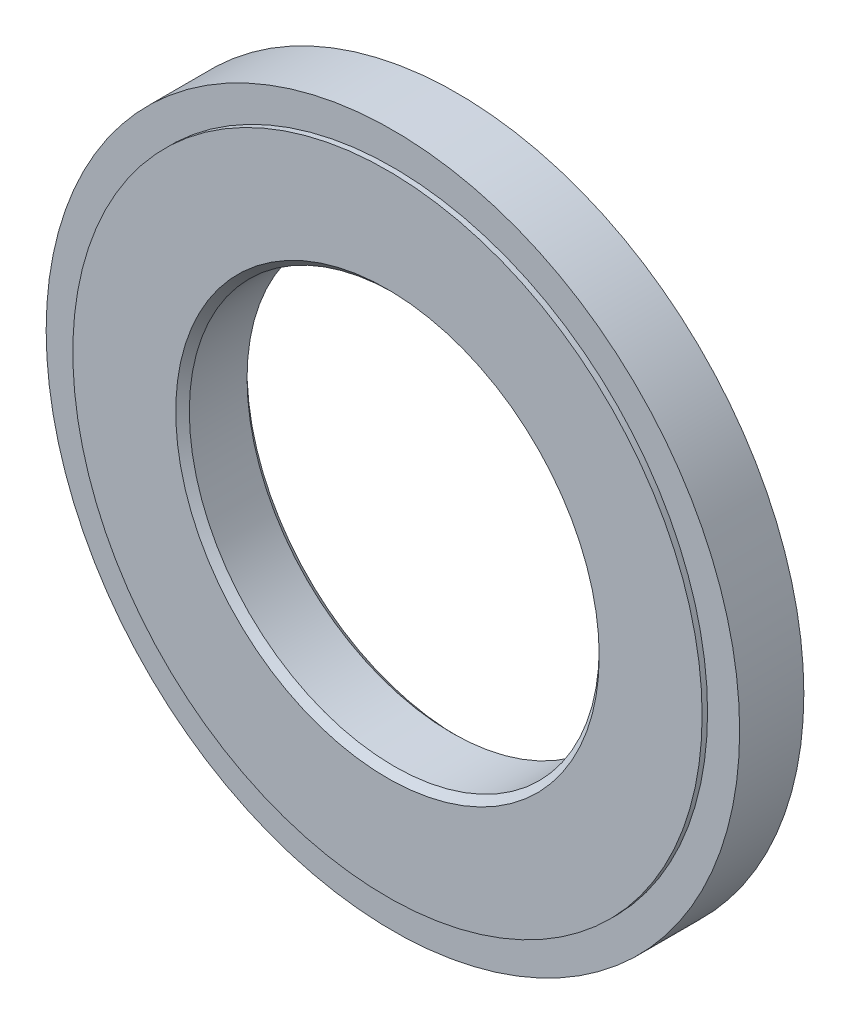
SolidWorks part; units mm, degrees
ref_plane "Front" through (0, 0, 0) normal (0, 0, 1) x (1, 0, 0)
ref_plane "Top" through (0, 0, 0) normal (0, 1, 0) x (1, 0, 0)
ref_plane "Right" through (0, 0, 0) normal (1, 0, 0) x (0, 0, -1)
sketch "Sketch1" plane through (0, 0, 0) normal (0, 0, 1) x (1, 0, 0)
  circle A0 centre (0, 0) radius 102.1
  dimension "OD" = 204.2
extrude "Extrude1" add sketch "Sketch1" along normal mid plane 21
sketch "Sketch2" plane through (0, 0, 10.5) normal (0, 0, 1) x (1, 0, 0)
  circle A0 centre (0, 0) radius 92.65
  dimension "MG" = 185.3
extrude "Cut-Extrude1" cut sketch "Sketch2" against normal blind 1.6 contours A0 M2
sketch "Sketch3" plane through (0, 0, -10.5) normal (0, 0, -1) x (-1, 0, 0)
  circle A0 centre (0, 0) radius 92.65
  dimension "MG" = 185.3
extrude "Cut-Extrude2" cut sketch "Sketch3" against normal blind 0.5 contours A0 M2
sketch "Sketch4" plane through (0, 0, 10.5) normal (0, 0, 1) x (1, 0, 0)
  circle A0 centre (0, 0) radius 60.35
  dimension "BORE" = 120.7
extrude "Cut-Extrude3" cut sketch "Sketch4" against normal through all
sketch "Sketch5" plane through (0, 0, -39) normal (0, 0, 1) x (1, 0, 0)
  point P0 (0, 50)
  point P1 (50, 0)
  point P2 (0, -50)
  point P3 (-50, 0)
  dimension "D1" = 76.2
  dimension "D2" = 76.2
  dimension "D3" = 76.2
  dimension "D4" = 76.2
hole_wizard "M5x0.8 Tapped Hole1" positions "3DSketch1" profile "Sketch6" tap size "M5x0.8" standard "Ansi Metric"
sketch3d "3DSketch1"
  point P0 (0, 32, -43.05)
  point P3 (-32, 0, -43.05)
  point P6 (32, 0, -43.05)
  point P9 (0, -32, -43.05)
sketch "Sketch6" plane through (0, 32, -43.05) normal (1, 0, 0) x (0, 1, 0)
  line L0 (0, 0) -> (0, 13.9618)
  line L1 (0, 13.9618) -> (2.1, 12.7)
  line L2 (2.1, 12.7) -> (2.1, 0)
  line L5 (2.1, 0) -> (0, 0)
  line L10 (0, 13.9618) -> (-2.1, 12.7) construction
  line L11 (0, -6.35) -> (0, 107.95) construction
  dimension "Tap Drill Dia." = 4.2
  dimension "Tap Drill Depth" = 12.7
  dimension "Drill Angle" = 118
chamfer "Chamfer1" distance 2 angle 45 2 edges at (60.35, 0, -10.5) (60.35, 0, 10.5)
sketch "Sketch7" plane through (0, 0, -10.5) normal (0, 0, -1) x (-1, 0, 0)
  point P0 (53.8815, 53.8815)
  point P1 (53.8815, -53.8815)
  point P3 (0, 76.2)
  point P4 (0, -76.2)
  point P5 (-53.8815, -53.8815)
  point P7 (-53.8815, 53.8815)
  dimension "D1" = 53.8815
  dimension "D2" = 53.8815
  dimension "D3" = 53.8815
  dimension "D4" = 53.8815
  dimension "D5" = 76.2
  dimension "D6" = 76.2
hole_wizard "Ø3.2 (3.2) Diameter Hole1" positions "3DSketch2" profile "Sketch8" hole size "Ø3.2" standard "Ansi Metric"
sketch3d "3DSketch2"
  point P0 (0, 76.2, -10.5)
  point P3 (0, -76.2, -10.5)
sketch "Sketch8" plane through (0, 76.2, -10.5) normal (1, 0, 0) x (0, 1, 0)
  line L0 (0, 0) -> (0, 4.8)
  line L1 (0, 4.8) -> (1.6, 4.8)
  line L2 (1.6, 4.8) -> (1.6, 0)
  line L5 (1.6, 0) -> (0, 0)
  line L10 (0, 4.8) -> (-1.6, 4.8) construction
  line L11 (0, -6.35) -> (0, 107.95) construction
  dimension "Hole Dia." = 3.2
  dimension "Hole Depth" = 4.8
  dimension "Drill Angle" = 180
hole_wizard "M6x1.0 Tapped Hole1" positions "3DSketch3" profile "Sketch9" tap size "M6x1.0" standard "Ansi Metric"
sketch3d "3DSketch3"
  point P0 (53.8815, 53.8815, -10.5)
  point P3 (-53.8815, 53.8815, -10.5)
  point P6 (-53.8815, -53.8815, -10.5)
  point P9 (53.8815, -53.8815, -10.5)
sketch "Sketch9" plane through (53.8815, 53.8815, -10.5) normal (1, 0, 0) x (0, 1, 0)
  line L0 (0, 0) -> (0, 14.2022)
  line L1 (0, 14.2022) -> (2.5, 12.7)
  line L2 (2.5, 12.7) -> (2.5, 0)
  line L5 (2.5, 0) -> (0, 0)
  line L10 (0, 14.2022) -> (-2.5, 12.7) construction
  line L11 (0, -6.35) -> (0, 107.95) construction
  dimension "Tap Drill Dia." = 5
  dimension "Tap Drill Depth" = 12.7
  dimension "Drill Angle" = 118
hole_wizard "Ø3.2 (3.2) Diameter Hole2" positions "3DSketch4" profile "Sketch10" hole size "Ø3.2" standard "Ansi Metric"
sketch3d "3DSketch4"
  point P1 (0, 6.8834, -34.4)
  point P4 (0, -6.8834, -34.4)
sketch "Sketch10" plane through (0, 6.8834, -34.4) normal (1, 0, 0) x (0, 1, 0)
  line L0 (0, 0) -> (0, 7.6)
  line L1 (0, 7.6) -> (1.6, 7.6)
  line L2 (1.6, 7.6) -> (1.6, 0)
  line L5 (1.6, 0) -> (0, 0)
  line L10 (0, 7.6) -> (-1.6, 7.6) construction
  line L11 (0, -6.35) -> (0, 107.95) construction
  dimension "Hole Dia." = 3.2
  dimension "Hole Depth" = 7.6
  dimension "Drill Angle" = 180
hole_wizard "M3x0.5 Tapped Hole1" positions "3DSketch5" profile "Sketch11" tap size "M3x0.5" standard "Ansi Metric"
sketch3d "3DSketch5"
  point P1 (6.8834, 0, -34.4)
  point P4 (-6.8834, 0, -34.4)
sketch "Sketch11" plane through (6.8834, 0, -34.4) normal (1, 0, 0) x (0, 1, 0)
  line L0 (0, 0) -> (0, 5.5511)
  line L1 (0, 5.5511) -> (1.25, 4.8)
  line L2 (1.25, 4.8) -> (1.25, 0)
  line L5 (1.25, 0) -> (0, 0)
  line L10 (0, 5.5511) -> (-1.25, 4.8) construction
  line L11 (0, -6.35) -> (0, 107.95) construction
  dimension "Tap Drill Dia." = 2.5
  dimension "Tap Drill Depth" = 4.8
  dimension "Drill Angle" = 118
hole_wizard "M4x0.7 Tapped Hole1" positions "3DSketch6" profile "Sketch12" tap size "M4x0.7" standard "Ansi Metric"
sketch3d "3DSketch6"
  point P0 (0, 18, -67.5)
  point P3 (18, 0, -67.5)
  point P6 (0, -18, -67.5)
  point P9 (-18, 0, -67.5)
sketch "Sketch12" plane through (0, 18, -67.5) normal (1, 0, 0) x (0, 1, 0)
  line L0 (0, 0) -> (0, 8.9914)
  line L1 (0, 8.9914) -> (1.65, 8)
  line L2 (1.65, 8) -> (1.65, 0)
  line L5 (1.65, 0) -> (0, 0)
  line L10 (0, 8.9914) -> (-1.65, 8) construction
  line L11 (0, -6.35) -> (0, 107.95) construction
  dimension "Tap Drill Dia." = 3.3
  dimension "Tap Drill Depth" = 8
  dimension "Drill Angle" = 118
hole_wizard "M6x1.0 Tapped Hole2" positions "3DSketch7" profile "Sketch13" tap size "M6x1.0" standard "Ansi Metric"
sketch3d "3DSketch7"
  point P0 (-50, 0, -39)
  point P3 (0, 50, -39)
  point P6 (0, -50, -39)
  point P9 (50, 0, -39)
sketch "Sketch13" plane through (-50, 0, -39) normal (1, 0, 0) x (0, 1, 0)
  line L0 (0, 0) -> (0, 14.2022)
  line L1 (0, 14.2022) -> (2.5, 12.7)
  line L2 (2.5, 12.7) -> (2.5, 0)
  line L5 (2.5, 0) -> (0, 0)
  line L10 (0, 14.2022) -> (-2.5, 12.7) construction
  line L11 (0, -6.35) -> (0, 107.95) construction
  dimension "Tap Drill Dia." = 5
  dimension "Tap Drill Depth" = 12.7
  dimension "Drill Angle" = 118
